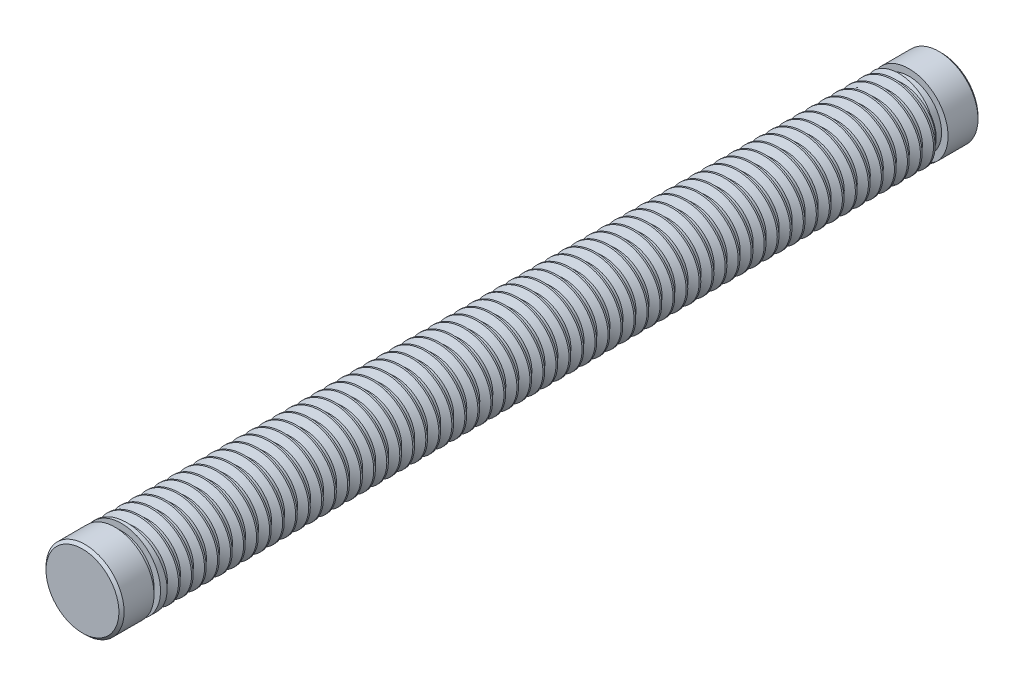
SolidWorks part; units mm, degrees
ref_plane "Front Plane" through (0, 0, 0) normal (0, 0, 1) x (1, 0, 0)
ref_plane "Top Plane" through (0, 0, 0) normal (0, 1, 0) x (1, 0, 0)
ref_plane "Right Plane" through (0, 0, 0) normal (1, 0, 0) x (0, 0, -1)
sketch "Sketch1" plane through (0, 0, 0) normal (1, 0, 0) x (0, 0, -1)
  line L0 (0, 3) -> (-30, 3)
  line L1 (0, 0) -> (0, 3)
  line L2 (-30, 3) -> (-30, 2.5)
  line L3 (-30, 2.5) -> (-30.5, 2.5)
  line L4 (-30.5, 2.5) -> (-30.5, 3)
  line L5 (-30.5, 3) -> (-33, 3)
  line L6 (-33, 3) -> (-33, 0)
  line L7 (-19.6253, 0) -> (5.3747, 0) construction
  line L8 (0, 0) -> (-33, 0)
  dimension "D1" = 33
  dimension "D2" = 3
  dimension "D3" = 30
  dimension "D4" = 0.5
  dimension "D6" = 0.5
revolve "Revolve1" add sketch "Sketch1" angle 360 about L7
chamfer "Chamfer1" distance 0.2 angle 45 1 edges at (0, -3, 33)
mirror "Mirror1" about plane through (0, 0, 0) normal (0, 0, 1) of "Chamfer1", "Revolve1"
thread "Thread1" pitch 1 start angle 0, offset 0, length 0, pitch 1, diameter 6
ref_plane "Plane1" through (-3, 0, 30) normal (0, -1, 0) x (-1, 0, 0)
sketch "Thread Profile1" plane through (-3, 0, 30) normal (0, -1, 0) x (-1, 0, 0)
  line L0 (0, 0) -> (0, 1) construction
  line L11 (0, 0) -> (0, 0.875)
  line L12 (0, 0.875) -> (-0.5413, 0.5625)
  line L13 (-0.5413, 0.5625) -> (-0.5413, 0.3125)
  line L15 (-0.5413, 0.3125) -> (0, 0)
  line L17 (-0.5413, 0.4375) -> (0, 0.4375) construction
  point P2 (0, 0)
  dimension "Pitch" = 1
  dimension "Profile_Angle" = 60
  dimension "Profile_Land" = 0.25
  dimension "Profile_Height" = 0.5413
